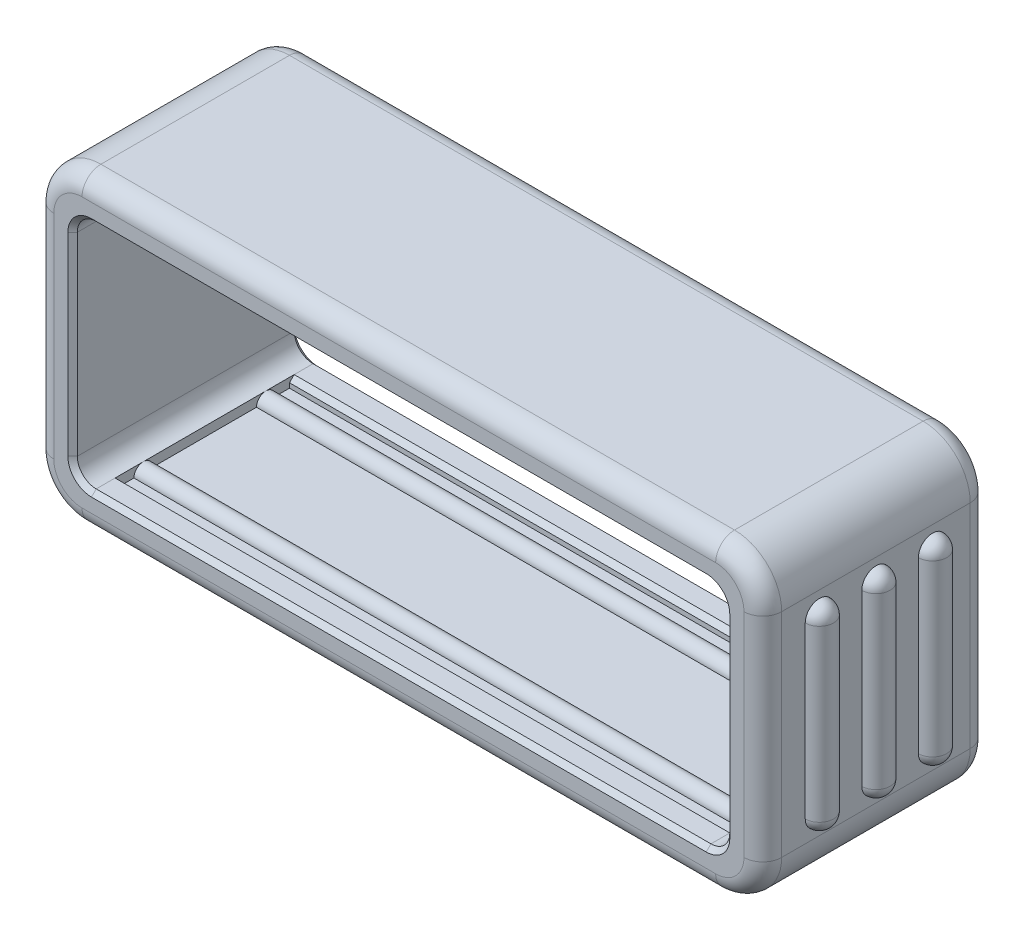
SolidWorks part; units mm, degrees
ref_plane "Front Plane" through (0, 0, 0) normal (0, 0, 1) x (1, 0, 0)
ref_plane "Top Plane" through (0, 0, 0) normal (0, 1, 0) x (1, 0, 0)
ref_plane "Right Plane" through (0, 0, 0) normal (1, 0, 0) x (0, 0, -1)
sketch "Sketch1" plane through (0, 0, 0) normal (0, 0, 1) x (1, 0, 0)
  line L1 (-8.7885, 3.1209) -> (8.7885, 3.1209)
  line L2 (-8.7885, 3.1209) -> (-8.7885, -3.1209)
  line L3 (-8.7885, -3.1209) -> (8.7885, -3.1209)
  line L4 (8.7885, 3.1209) -> (8.7885, -3.1209)
  line L8 (-8.7885, 3.1209) -> (8.7885, -3.1209) construction
  line L9 (-9.8045, 4.1369) -> (9.8045, 4.1369)
  line L10 (9.8045, 4.1369) -> (9.8045, -4.1369)
  line L11 (-9.8045, -4.1369) -> (9.8045, -4.1369)
  line L12 (-9.8045, 4.1369) -> (-9.8045, -4.1369)
  dimension "D1" = 17.577
  dimension "D2" = 6.2418
  dimension "D3" = 1.016
extrude "Boss-Extrude1" add sketch "Sketch1" along normal blind 6.096
fillet "Fillet1" radius 0.508 4 edges at (8.7885, 3.1209, 3.048) (8.7885, -3.1209, 3.048) (-8.7885, -3.1209, 3.048) (-8.7885, 3.1209, 3.048)
fillet "Fillet2" radius 1.27 4 edges at (-9.8045, -4.1369, 3.048) (-9.8045, 4.1369, 3.048) (9.8045, 4.1369, 3.048) (9.8045, -4.1369, 3.048)
fillet "Fillet3" radius 0.508 16 edges at (9.4325, 3.7649, 0) (9.8045, 0, 0) (9.4325, -3.7649, 0) (0, -4.1369, 0) (-9.4325, -3.7649, 0) (-9.8045, 0, 0) (-9.4325, 3.7649, 0) (9.4325, 3.7649, 6.096) (9.8045, 0, 6.096) (9.4325, -3.7649, 6.096) (0, -4.1369, 6.096) (-9.4325, -3.7649, 6.096) (-9.8045, 0, 6.096) (-9.4325, 3.7649, 6.096) (0, 4.1369, 0) (0, 4.1369, 6.096)
sketch "Sketch2" plane through (0, 0, 0) normal (0, 1, 0) x (1, 0, 0)
  line L0 (-9.8045, -5.588) -> (-9.8045, -0.508) construction
  line L1 (-8.5345, 0) -> (8.5345, 0) construction
  circle A0 centre (-9.8045, -1.524) radius 0.381
  dimension "D1" = 0.762
  dimension "D2" = 1.524
extrude "Boss-Extrude2" add sketch "Sketch2" along normal mid plane 4.572
sketch "Sketch3" plane through (0, 2.286, 0) normal (0, 1, 0) x (1, 0, 0)
  line L1 (-9.8045, -1.905) -> (-9.8045, -1.143)
  line L2 (-9.8045, -1.905) -> (-9.8045, -1.143)
  arc A1 (-9.8045, -1.143) -> (-9.8045, -1.905) centre (-9.8045, -1.524) ccw
  arc A2 (-9.8045, -1.143) -> (-9.8045, -1.905) centre (-9.8045, -1.524) ccw
  dimension "D1" = 0
revolve "Revolve1" add sketch "Sketch3" angle 360 about L2
sketch "Sketch4" plane through (0, -2.286, 0) normal (0, -1, 0) x (1, 0, 0)
  line L1 (-9.8045, 1.143) -> (-9.8045, 1.905)
  line L2 (-9.8045, 1.143) -> (-9.8045, 1.905)
  arc A1 (-9.8045, 1.905) -> (-9.8045, 1.143) centre (-9.8045, 1.524) ccw
  arc A2 (-9.8045, 1.905) -> (-9.8045, 1.143) centre (-9.8045, 1.524) ccw
  dimension "D1" = 0
revolve "Revolve2" add sketch "Sketch4" angle 360 about L2
pattern_linear "LPattern1" count 3 spacing 1.524 along (0, 0, 1) of "Revolve2", "Boss-Extrude2", "Revolve1"
mirror "Mirror1" about plane through (0, 0, 0) normal (1, 0, 0) of "LPattern1", "Revolve2", "Revolve1", "Boss-Extrude2"
chamfer "Chamfer1" distance 0.127 angle 45 16 edges at (0, 3.1209, 6.096) (-8.6397, 2.9721, 6.096) (8.6397, 2.9721, 6.096) (-8.7885, 0, 6.096) (8.7885, 0, 6.096) (-8.6397, -2.9721, 6.096) (8.6397, -2.9721, 6.096) (0, -3.1209, 6.096) (0, 3.1209, 0) (-8.6397, 2.9721, 0) (8.6397, 2.9721, 0) (-8.7885, 0, 0) (8.7885, 0, 0) (-8.6397, -2.9721, 0) (8.6397, -2.9721, 0) (0, -3.1209, 0)
sketch "Sketch5" plane through (0, 0, 0) normal (0, 0, -1) x (-1, 0, 0)
  line L0 (8.2805, 3.1209) -> (-8.2805, 3.1209) construction
  line L1 (-8.2805, -3.3749) -> (8.2805, -3.3749)
  line L2 (-8.2805, -3.3749) -> (-8.2805, 3.3749)
  line L3 (-8.2805, 3.3749) -> (8.2805, 3.3749)
  line L4 (8.2805, -3.3749) -> (8.2805, 3.3749)
  line L5 (-8.2805, -3.1209) -> (8.2805, -3.1209) construction
  line L6 (-8.7885, 2.6129) -> (-8.7885, -2.6129) construction
  line L7 (8.7885, -2.6129) -> (8.7885, 2.6129) construction
  dimension "D1" = 0.254
  dimension "D2" = 0.254
  dimension "D3" = 0.508
  dimension "D4" = 0.508
extrude "Cut-Extrude1" cut sketch "Sketch5" against normal blind 4.572 from offset 0.762
sketch "Sketch6" plane through (8.2805, 0, 0) normal (-1, 0, 0) x (0, 0, 1)
  line L0 (5.334, 3.3749) -> (0.762, 3.3749) construction
  line L1 (5.334, -3.3749) -> (0.762, -3.3749) construction
  line L2 (5.334, 3.3749) -> (5.334, 3.1209) construction
  line L3 (0.762, 3.3749) -> (0.762, 3.1209) construction
  circle A0 centre (1.397, 3.3749) radius 0.254
  circle A1 centre (4.699, 3.3749) radius 0.254
  circle A2 centre (1.397, -3.3749) radius 0.254
  circle A3 centre (4.699, -3.3749) radius 0.254
  dimension "D2" = 0.635
  dimension "D3" = 0.508
  dimension "D1" = 0.635
extrude "Boss-Extrude3" add sketch "Sketch6" along normal up to next
chamfer "Chamfer2" distance 0.127 angle 45 4 edges at (0, 3.1209, 5.334) (0, 3.1209, 0.762) (0, -3.1209, 5.334) (0, -3.1209, 0.762)
